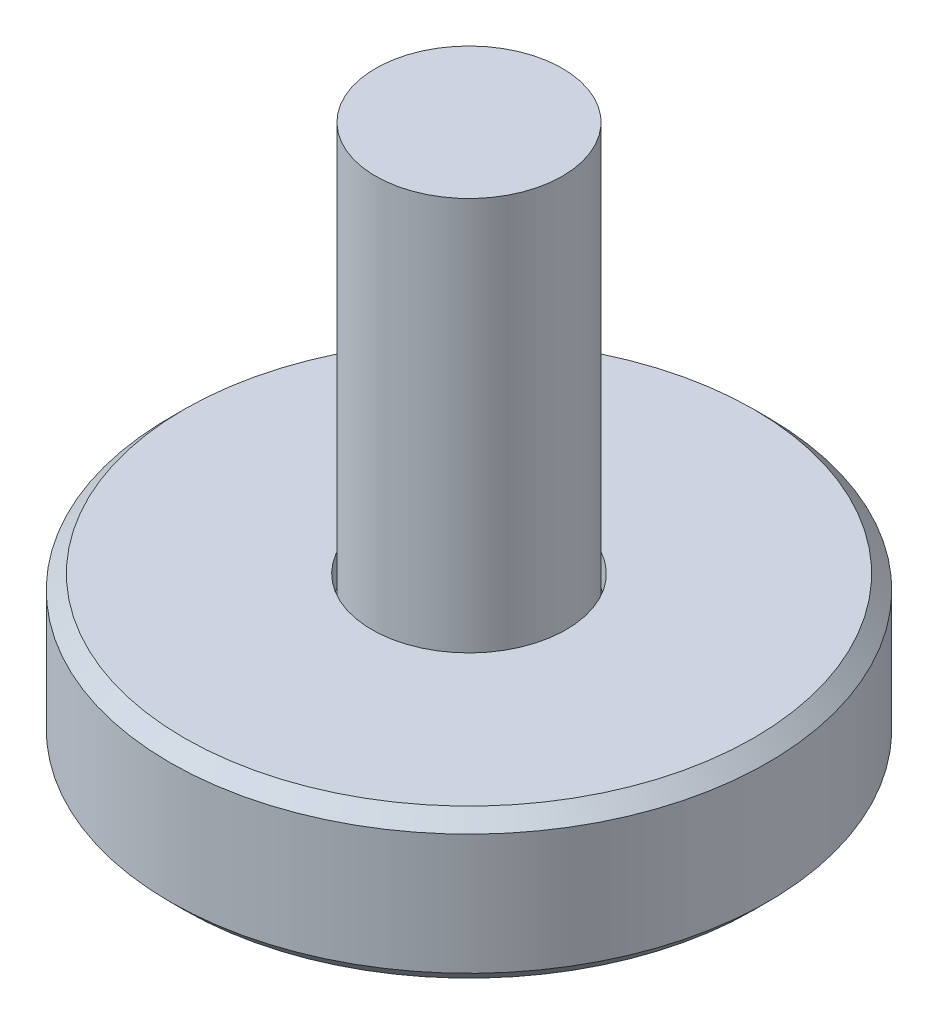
SolidWorks part; units mm, degrees
other "<FHCSM5L14>-<HEX>"
ref_plane "Front Plane" through (0, 0, 0) normal (0, 0, 1) x (1, 0, 0)
ref_plane "Top Plane" through (0, 0, 0) normal (0, 1, 0) x (1, 0, 0)
ref_plane "Right Plane" through (0, 0, 0) normal (1, 0, 0) x (0, 0, -1)
sketch "Sketch1" plane through (0, 0, 0) normal (0, 1, 0) x (1, 0, 0)
  circle A0 centre (0, 0) radius 8.001
  dimension "D1" = 16.002
extrude "Extrude1" add sketch "Sketch1" along normal blind 3.9878
chamfer "Chamfer1" distance 0.381 angle 45 2 edges at (0, 0, 8.001) (0, 3.9878, 8.001)
sketch "Sketch2" plane through (0, 0, 0) normal (0, 0, 1) x (1, 0, 0)
  line L0 (0, -2.05) -> (0, 7.8227) construction
  line L1 (0, 0) -> (5.75, 0)
  line L2 (-7.62, 0) -> (7.62, 0) construction
  line L3 (5.75, 0) -> (2.6, 3.15)
  line L4 (2.6, 3.15) -> (2.6, 3.9878)
  line L5 (7.62, 3.9878) -> (-7.62, 3.9878) construction
  line L6 (2.6, 3.9878) -> (0, 3.9878)
  line L7 (0, 3.9878) -> (0, 0)
  dimension "D1" = 5.2
  dimension "D2" = 3.15
  dimension "D3" = 45
revolve "Cut-Revolve1" cut sketch "Sketch2" angle 360 about L0
inserted part "FHCSM5L14"
move or copy body "Body-Move/Copy2" placed by mates yes
